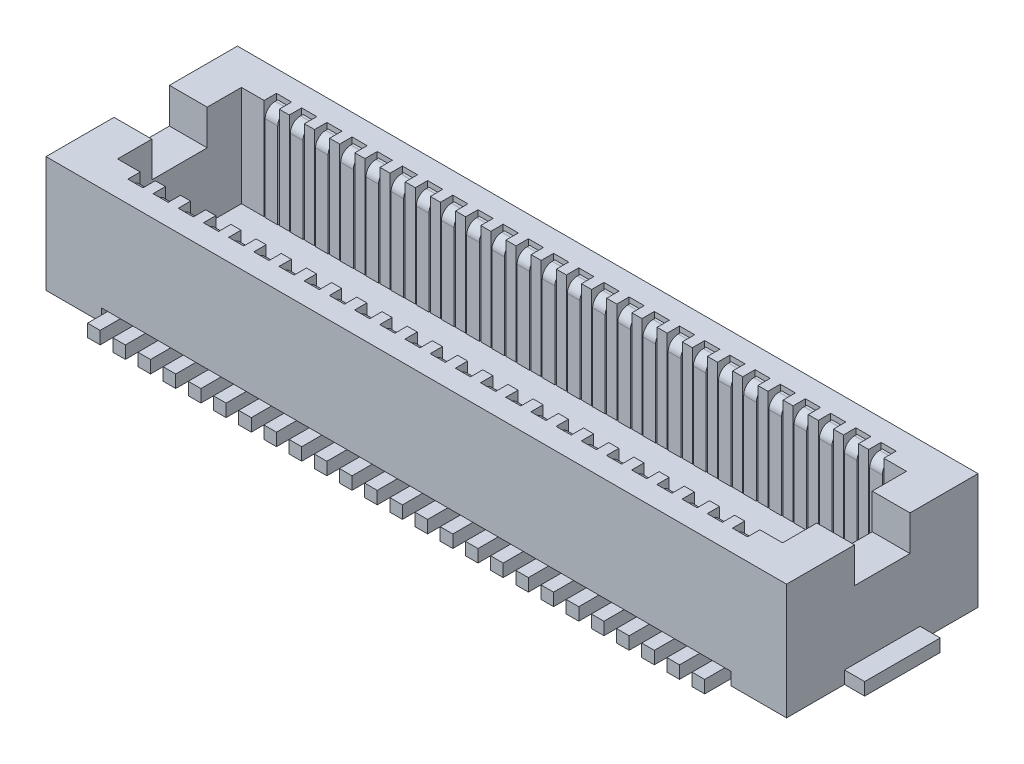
SolidWorks part; units mm, degrees
ref_plane "Front" through (0, 0, 0) normal (0, 0, 1) x (1, 0, 0)
ref_plane "Top" through (0, 0, 0) normal (0, 1, 0) x (1, 0, 0)
ref_plane "Right" through (0, 0, 0) normal (1, 0, 0) x (0, 0, -1)
sketch "Эскиз1" plane through (0, 0, 0) normal (0, 1, 0) x (1, 0, 0)
  line L1 (-7.35, -1.9) -> (7.35, -1.9)
  line L2 (-7.35, -1.9) -> (-7.35, 1.9)
  line L3 (-7.35, 1.9) -> (7.35, 1.9)
  line L4 (7.35, -1.9) -> (7.35, 1.9)
  line L5 (-7.35, -1.9) -> (7.35, 1.9) construction
  line L6 (-7.35, 1.9) -> (7.35, -1.9) construction
  point P0 (0, 0)
  dimension "D1" = 3.8
  dimension "A" = 14.7
extrude "Вытянуть1" add sketch "Эскиз1" along normal blind 2.3
sketch "Эскиз2" plane through (0, 0, 0) normal (0, 0, 1) x (1, 0, 0)
  line L0 (-7.35, 0) -> (7.35, 0) construction
  line L1 (-6.25, 0) -> (6.25, 0)
  line L2 (-6.25, 0) -> (-6.25, 0.25)
  line L3 (-6.25, 0.25) -> (6.25, 0.25)
  line L4 (6.25, 0) -> (6.25, 0.25)
  dimension "D1" = 0.25
  dimension "D2" = 12.5
extrude "Вытянуть2" cut sketch "Эскиз2" against normal through all and the other way through all
sketch "Эскиз3" plane through (0, 2.3, 0) normal (0, 1, 0) x (1, 0, 0)
  line L1 (-6.6, -1.23) -> (6.6, -1.23)
  line L2 (-6.6, -1.23) -> (-6.6, 1.23)
  line L3 (-6.6, 1.23) -> (6.6, 1.23)
  line L4 (6.6, -1.23) -> (6.6, 1.23)
  line L5 (-6.6, -1.23) -> (6.6, 1.23) construction
  line L6 (-6.6, 1.23) -> (6.6, -1.23) construction
  point P0 (0, 0)
  dimension "D1" = 13.2
  dimension "D2" = 2.46
extrude "Вытянуть3" cut sketch "Эскиз3" against normal blind 2
sketch "Эскиз4" plane through (0, 2.3, 0) normal (0, 1, 0) x (1, 0, 0)
  line L0 (-7.35, 1.9) -> (-7.35, -1.9) construction
  line L1 (-7.35, -0.55) -> (-6.6, -0.55)
  line L2 (-7.35, -0.55) -> (-7.35, 0.55)
  line L3 (-7.35, 0.55) -> (-6.6, 0.55)
  line L4 (-6.6, -0.55) -> (-6.6, 0.55)
  line L5 (-6.6, 1.23) -> (-6.6, -1.23) construction
  line L6 (6.6, -1.23) -> (6.6, 1.23) construction
  line L7 (6.6, -0.55) -> (7.35, -0.55)
  line L8 (6.6, -0.55) -> (6.6, 0.55)
  line L9 (6.6, 0.55) -> (7.35, 0.55)
  line L10 (7.35, -0.55) -> (7.35, 0.55)
  line L11 (7.35, -1.9) -> (7.35, 1.9) construction
  line L12 (-6.6, 0) -> (6.6, 0) construction
  dimension "D1" = 1.1
extrude "Вытянуть4" cut sketch "Эскиз4" against normal blind 0.7
ref_plane "Pin1Plane" through (-6, 0, 0) normal (1, 0, 0) x (0, 0, -1)
sketch "Эскиз5" plane through (-6, 0, 0) normal (1, 0, 0) x (0, 0, -1)
  line L0 (-1.9, 2.3) -> (-0.55, 2.3) construction
  line L1 (-1.475, 2.3) -> (1.475, 2.3)
  line L2 (-1.475, 2.3) -> (-1.475, 0.3)
  line L3 (-1.475, 0.3) -> (1.475, 0.3)
  line L4 (1.475, 2.3) -> (1.475, 0.3)
  line L5 (0, 0) -> (0, 0.3) construction
  line L6 (-1.23, 0.3) -> (1.23, 0.3) construction
  line L7 (-1.23, 0.3) -> (-1.23, 2.3) construction
  dimension "D1" = 2.95
  dimension "D2" = 0.245
extrude "Вытянуть5" cut sketch "Эскиз5" against normal mid plane 0.3
pattern_linear "Линейный массив1" count 25 spacing 0.5 along (1, 0, 0) of "Вытянуть5"
sketch "Эскиз6" plane through (-6, 0, 0) normal (1, 0, 0) x (0, 0, -1)
  line L0 (-2.3, 0) -> (-1.525, 0)
  line L1 (1.9, 0) -> (-1.9, 0) construction
  line L2 (-1.225, 0.3) -> (-1.225, 2)
  line L3 (-2.3, 0.25) -> (-1.525, 0.25)
  line L4 (-1.475, 0.3) -> (-1.475, 2.2)
  line L5 (-1.475, 2.2) -> (-1.425, 2.2)
  line L6 (-2.3, 0.25) -> (-2.3, 0)
  line L7 (0, 0) -> (0, 1.6) construction
  line L8 (-0.55, 1.6) -> (0.55, 1.6) construction
  line L9 (-0.55, 2.3) -> (-1.9, 2.3) construction
  line L10 (2.3, 0.25) -> (2.3, 0)
  line L11 (1.475, 2.2) -> (1.425, 2.2)
  line L12 (1.475, 0.3) -> (1.475, 2.2)
  line L13 (2.3, 0.25) -> (1.525, 0.25)
  line L14 (1.225, 0.3) -> (1.225, 2)
  line L15 (-1.225, 0.3) -> (-1.225, 2.2) construction
  line L16 (-1.475, 2.3) -> (-1.475, 0.3) construction
  line L17 (2.3, 0) -> (1.525, 0)
  arc A0 (-1.525, 0) -> (-1.225, 0.3) centre (-1.525, 0.3) ccw
  arc A1 (-1.525, 0.25) -> (-1.475, 0.3) centre (-1.525, 0.3) ccw
  arc A2 (1.225, 2) -> (1.425, 2.2) centre (1.425, 2) cw
  arc A3 (1.525, 0.25) -> (1.475, 0.3) centre (1.525, 0.3) cw
  arc A4 (-1.225, 2) -> (-1.425, 2.2) centre (-1.425, 2) ccw
  arc A5 (1.525, 0) -> (1.225, 0.3) centre (1.525, 0.3) cw
  point P8 (-1.225, 0)
  dimension "D1" = 0.3
  dimension "D4" = 0.2
  dimension "D3" = 0.1
  dimension "D5" = 4.6
  dimension "D2" = 0.25
extrude "Вытянуть6" add sketch "Эскиз6" along normal mid plane 0.25
pattern_linear "Линейный массив2" count 25 spacing 0.5 along (1, 0, 0) of "Вытянуть6"
sketch "Эскиз7" plane through (0, 0, 0) normal (0, 1, 0) x (1, 0, 0)
  line L0 (0, 0) -> (0, -0.7822) construction
  circle A0 centre (-7.05, -1.5) radius 0.25
  circle A1 centre (7.05, -1.5) radius 0.25
  dimension "D1" = 0.5
  dimension "D3" = 14.1
  dimension "D2" = 1.5
extrude "Boss" [suppressed] add sketch "Эскиз7" against normal blind 0.6
sketch "Эскиз8" plane through (0, 0, 0) normal (0, 1, 0) x (1, 0, 0)
  line L0 (-7.35, -0.55) -> (-7.35, -1.9) construction
  line L1 (-7.35, -0.75) -> (-7.75, -0.75)
  line L2 (-7.35, -0.75) -> (-7.35, 0.75)
  line L3 (-7.35, 0.75) -> (-7.75, 0.75)
  line L4 (-7.75, -0.75) -> (-7.75, 0.75)
  line L5 (7.35, -1.9) -> (7.35, -0.55) construction
  line L6 (7.35, -0.75) -> (7.75, -0.75)
  line L7 (7.35, -0.75) -> (7.35, 0.75)
  line L8 (7.35, 0.75) -> (7.75, 0.75)
  line L9 (7.75, -0.75) -> (7.75, 0.75)
  line L10 (-7.35, 0) -> (7.35, 0) construction
  dimension "D1" = 0.4
  dimension "D2" = 1.5
extrude "Fiting" add sketch "Эскиз8" along normal blind 0.25
equation "\"A@Эскиз1\" = (((\"NumberOfContacts\" / 2) - 1)  * 0.5)  + 2.7"
equation "\"D2@Эскиз2\" = \"NumberOfContacts\" / 2 * 0.5"
equation "\"D1@Эскиз3\" = (((\"NumberOfContacts\" / 2)  - 1)  * 0.5)  + 1.2"
equation "\"Pin1@Pin1Plane\" = (((\"NumberOfContacts\" / 2) - 1)  * 0.5)/2"
equation "\"D1@Линейный массив1\" = \"NumberOfContacts\" / 2"
equation "\"D1@Линейный массив2\" = \"NumberOfContacts\" / 2"
equation "\"D3@Эскиз7\" = (((\"NumberOfContacts\" / 2)  - 1)  * 0.5)  + 2.1"
equation "\"E@Вытянуть1\" = \"Height\" - 0.7"
